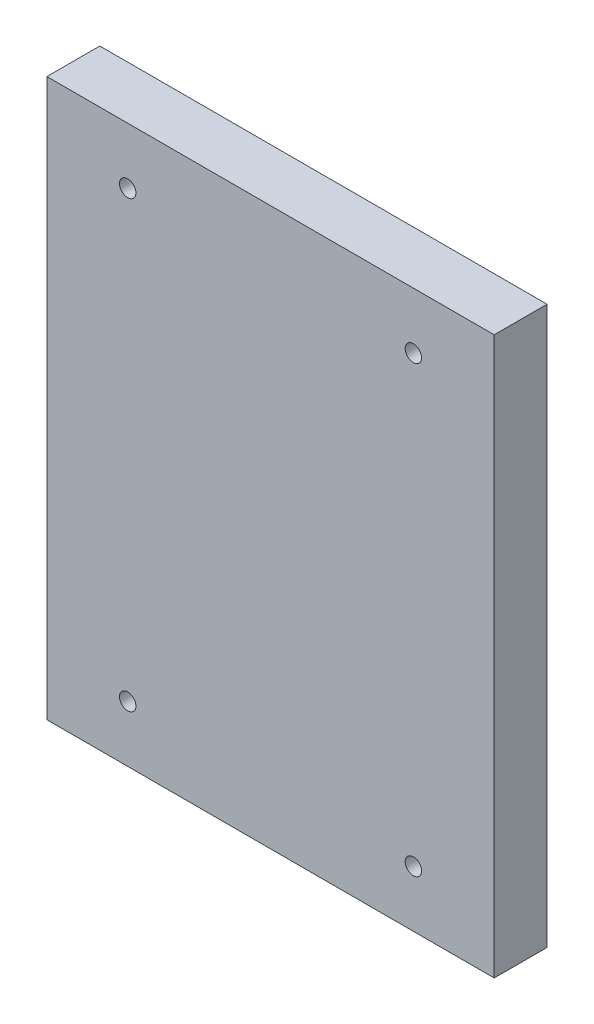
SolidWorks part; units mm, degrees
ref_plane "前视基准面" through (0, 0, 0) normal (0, 0, 1) x (1, 0, 0)
ref_plane "上视基准面" through (0, 0, 0) normal (0, 1, 0) x (1, 0, 0)
ref_plane "右视基准面" through (0, 0, 0) normal (1, 0, 0) x (0, 0, -1)
sketch "草图1" plane through (0, 0, 0) normal (0, 0, 1) x (1, 0, 0)
  line L1 (86.6469, 86.2616) -> (140.6469, 86.2616) construction
  line L2 (86.6469, 86.2616) -> (86.6469, 2.2616) construction
  line L3 (86.6469, 2.2616) -> (140.6469, 2.2616) construction
  line L4 (140.6469, 86.2616) -> (140.6469, 2.2616) construction
  line L5 (71.3727, 96.9073) -> (155.9211, 96.9073)
  line L6 (71.3727, 96.9073) -> (71.3727, -8.384)
  line L7 (71.3727, -8.384) -> (155.9211, -8.384)
  line L8 (155.9211, 96.9073) -> (155.9211, -8.384)
  line L9 (71.3727, 96.9073) -> (155.9211, -8.384) construction
  line L10 (71.3727, -8.384) -> (155.9211, 96.9073) construction
  circle A0 centre (86.6469, 86.2616) radius 1.55
  circle A1 centre (140.6469, 86.2616) radius 1.55
  circle A2 centre (140.6469, 2.2616) radius 1.55
  circle A3 centre (86.6469, 2.2616) radius 1.55
  point P10 (113.6469, 44.2616)
extrude "凸台-拉伸1" add sketch "草图1" along normal blind 10
